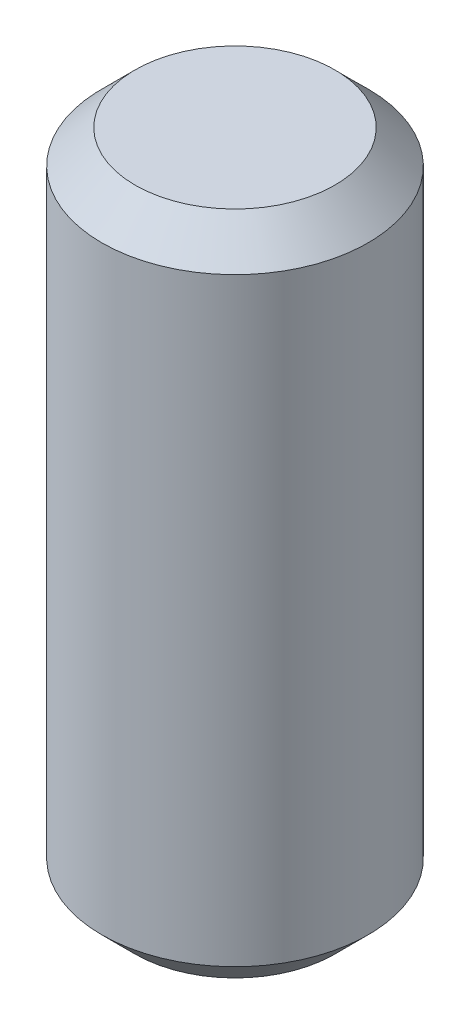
SolidWorks part; units mm, degrees
ref_plane "Face" through (0, 0, 0) normal (0, 0, 1) x (1, 0, 0)
ref_plane "Dessus" through (0, 0, 0) normal (0, 1, 0) x (1, 0, 0)
ref_plane "Droite" through (0, 0, 0) normal (1, 0, 0) x (0, 0, -1)
sketch "Esquisse1" plane through (0, 0, 0) normal (0, 0, 1) x (1, 0, 0)
  line L0 (0, 32.8092) -> (0, -30.7195) construction
  line L1 (3, 20) -> (0, 20)
  line L2 (4, 19) -> (4, 1)
  line L3 (3, 0) -> (0, 0)
  line L4 (0, 20) -> (0, 0)
  line L5 (4, 1) -> (3, 0)
  line L6 (4, 19) -> (3, 20)
  point P0 (4, 20)
  point P2 (4, 0)
  dimension "D1" = 8
  dimension "D2" = 20
  dimension "D6" = 1
  dimension "D7" = 1
revolve "Révolution1" add sketch "Esquisse1" angle 360 about L0
